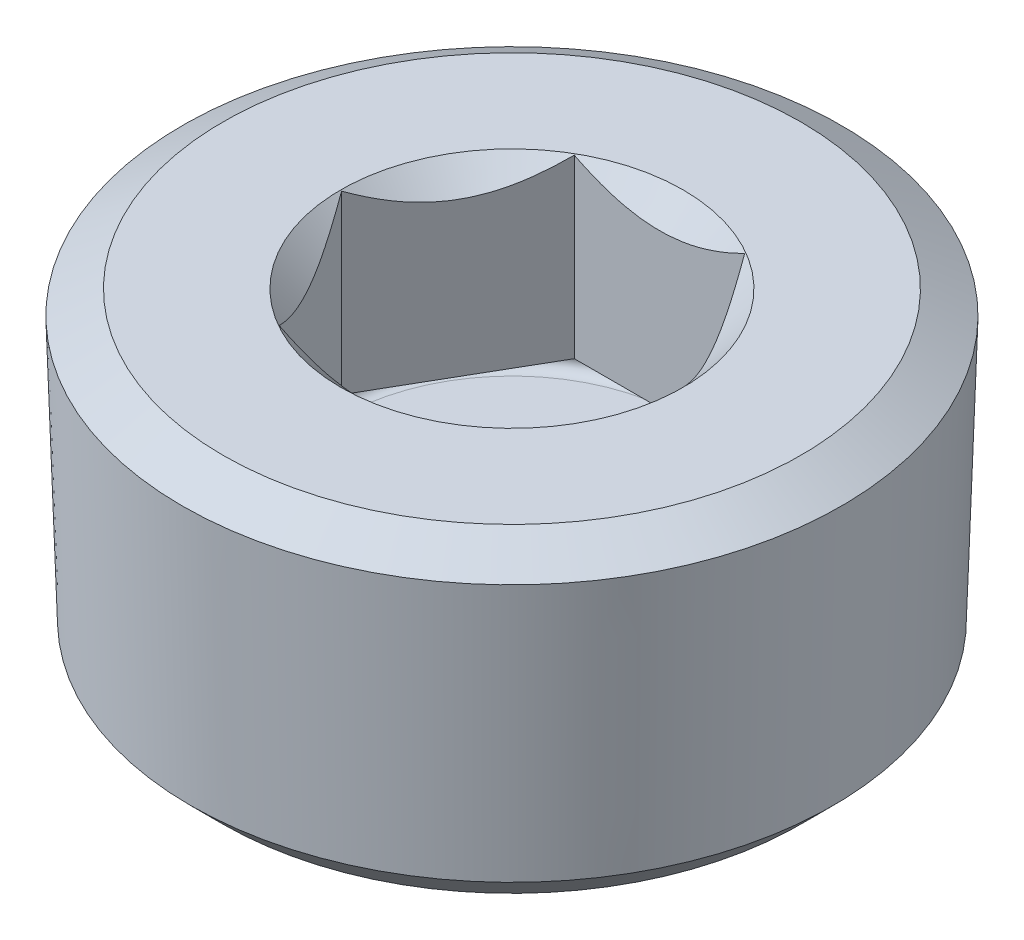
SolidWorks part; units mm, degrees
ref_plane "Front Plane" through (0, 0, 0) normal (0, 0, 1) x (1, 0, 0)
ref_plane "Top Plane" through (0, 0, 0) normal (0, 1, 0) x (1, 0, 0)
ref_plane "Right Plane" through (0, 0, 0) normal (1, 0, 0) x (0, 0, -1)
sketch "Sketch2" plane through (0, 0, 0) normal (0, 0, 1) x (1, 0, 0)
  line L0 (0, 10.7443) -> (0, -17.0657) construction
  line L1 (0, 0) -> (-18.6475, 0)
  line L2 (-21.2759, -1.5175) -> (-20.7449, -18.5273)
  line L3 (-18.6475, -20.6248) -> (0, -20.6248)
  line L4 (0, -20.6248) -> (0, 0)
  line L6 (-18.6475, -20.6248) -> (-20.7449, -18.5273)
  line L7 (-18.6475, 0) -> (-21.2759, -1.5175)
  point P4 (-21.3233, 0)
  point P6 (-20.6795, -20.6248)
  dimension "D1" = 20.6248
  dimension "D2" = 1.788
  dimension "D3" = 42.6466
  dimension "D4" = 30
  dimension "D5" = 2.032
  dimension "D6" = 45
revolve "Revolve1" add sketch "Sketch2" angle 360 about L0
sketch "Sketch3" plane through (0, 0, 0) normal (0, 0, 1) x (1, 0, 0)
  line L0 (0, 2.9342) -> (0, -18.7525) construction
  line L1 (0, 0) -> (-11.049, 0)
  line L2 (18.6475, 0) -> (-18.6475, 0) construction
  line L3 (-9.525, -1.524) -> (-9.525, -11.43)
  line L4 (-11.049, -12.7) -> (0, -12.7)
  line L5 (0, -12.7) -> (0, 0)
  line L6 (-9.525, -1.524) -> (-11.049, 0)
  line L7 (-9.525, -11.43) -> (-11.049, -11.43)
  arc A0 (-11.049, -11.43) -> (-11.049, -12.7) centre (-11.049, -12.065) ccw
  dimension "D1" = 11.43
  dimension "D2" = 12.7
  dimension "D3" = 19.05
  dimension "D4" = 1.524
  dimension "D5" = 45
  dimension "D6" = 1.524
revolve "Cut-Revolve1" cut sketch "Sketch3" angle 360 about L0
sketch "Sketch4" plane through (0, 0, 0) normal (0, 1, 0) x (1, 0, 0)
  line L1 (-5.4993, -9.525) -> (5.4993, -9.525)
  line L2 (5.4993, -9.525) -> (10.9985, 0)
  line L3 (10.9985, 0) -> (5.4993, 9.525)
  line L4 (5.4993, 9.525) -> (-5.4993, 9.525)
  line L5 (-5.4993, 9.525) -> (-10.9985, 0)
  line L6 (-10.9985, 0) -> (-5.4993, -9.525)
  circle A0 centre (0, 0) radius 9.525 construction
  circle A1 centre (0, 0) radius 9.525 construction
extrude "Cut-Extrude1" cut sketch "Sketch4" against normal up to vertex (5.2929 mm away)
